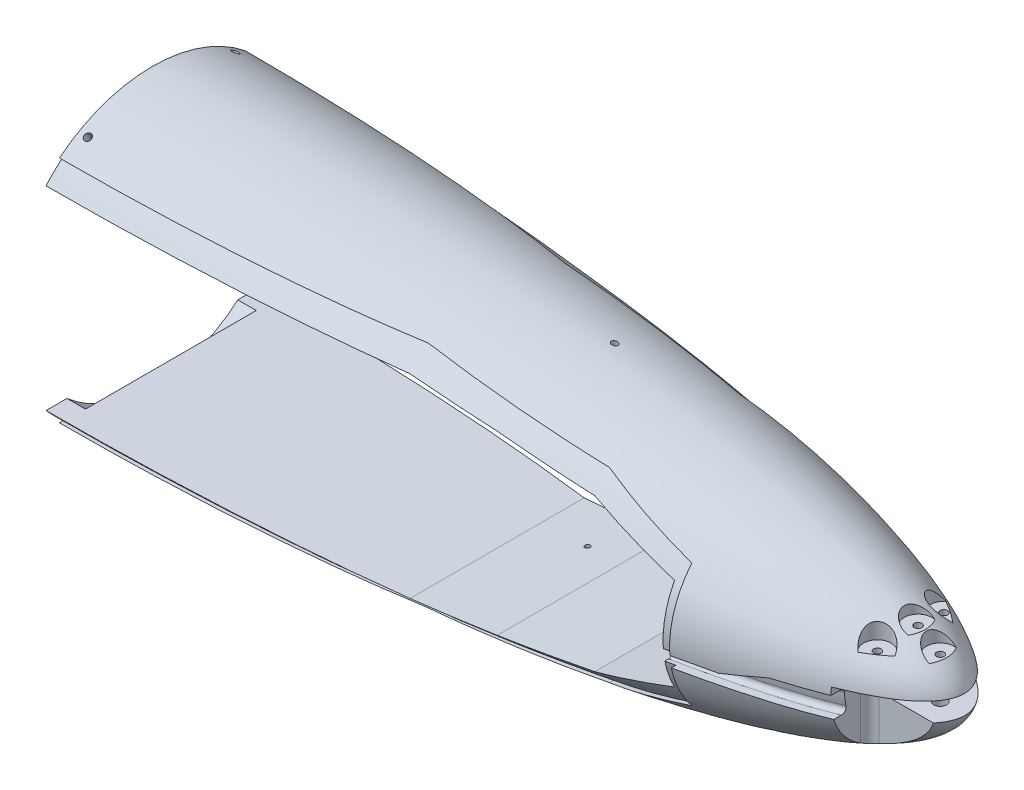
SolidWorks part; units mm, degrees
ref_plane "Plane1" through (0, 0, 0) normal (0, 0, 1) x (1, 0, 0)
ref_plane "Plane2" through (0, 0, 0) normal (0, 1, 0) x (1, 0, 0)
ref_plane "Plane3" through (0, 0, 0) normal (1, 0, 0) x (0, 0, -1)
sketch "Sketch1" plane through (0, 0, 0) normal (0, 0, 1) x (1, 0, 0)
  line L0 (0, 0) -> (558.8, 0) construction
  line L1 (558.8, 0) -> (0, 0)
  line L2 (0, 0) -> (0, 101.346)
  line L3 (0, 0) -> (558.8, 0) construction
  ellipse E0 centre (0, 0) end of major axis (558.8, 0) minor radius 101.346 (558.8, 0) -> (0, 101.346) ccw
  dimension "D1" = 558.8
  dimension "D2" = 101.346
revolve "Base-Revolve" add sketch "Sketch1" angle 180 about L0
sketch "Sketch2" plane through (0, 0, 0) normal (0, 0, 1) x (1, 0, 0)
  line L0 (415.29, 0) -> (0, 0) construction
  line L1 (0, 66.802) -> (236.728, 66.802)
  line L2 (236.728, 66.802) -> (294.64, 60.706)
  line L3 (294.64, 60.706) -> (358.14, 52.324)
  line L4 (358.14, 52.324) -> (415.29, 31.75)
  line L5 (415.29, 31.75) -> (415.29, -31.75)
  line L6 (0, -66.802) -> (0, 66.802)
  line L7 (358.14, -52.324) -> (415.29, -31.75)
  line L8 (294.64, -60.706) -> (358.14, -52.324)
  line L9 (236.728, -66.802) -> (294.64, -60.706)
  line L10 (0, -66.802) -> (236.728, -66.802)
  dimension "D1" = 236.728
  dimension "D2" = 57.912
  dimension "D3" = 63.5
  dimension "D4" = 57.15
  dimension "D5" = 66.802
  dimension "D6" = 60.706
  dimension "D7" = 52.324
  dimension "D8" = 31.75
  dimension "D9" = 415.29
extrude "Cut-Extrude2" cut sketch "Sketch2" against normal through all and the other way through all
sketch "Sketch3" plane through (0, 0, 0) normal (-1, 0, 0) x (0, 0, 1)
  line L0 (-101.346, 0) -> (-98.806, 0)
  arc A0 (76.2135, 66.802) -> (-76.2135, 66.802) centre (0, 0) ccw construction
  point P0 (0, 101.346)
  point P1 (101.346, 0)
  point P5 (-101.346, 0)
sketch "Sketch5" plane through (0, 0, 0) normal (-1, 0, 0) x (0, 0, 1)
  circle A0 centre (0, 0) radius 88.9
  dimension "D1" = 177.8
extrude "Cut-Extrude3" cut sketch "Sketch5" against normal blind 12.7
ref_plane "hole_off_plane" through (6.35, 0, 0) normal (-1, 0, 0) x (0, 0, 1)
ref_plane "perp_hole_plane" through (0, 0, 0) normal (0, 0.866, 0.5) x (-1, 0, 0)
sketch "Sketch9" plane through (0, 0, 0) normal (0, 0.866, 0.5) x (-1, 0, 0)
  line L0 (-6.35, -76.2135) -> (-6.35, 76.2135) construction
  circle A0 centre (-6.35, 0) radius 2.4257
  dimension "D1" = 4.8514
  dimension "D2" = 6.35
extrude "Cut-Extrude6" cut sketch "Sketch9" along normal through all
pattern_circular "CirPattern5" count 2 every 60 about axis through (0, 0, 0) along (1, 0, 0) of "Cut-Extrude6"
pattern_circular "CirPattern6" count 2 every 120 about axis through (0, 0, 0) along (1, 0, 0) of "Cut-Extrude6"
pattern_circular "CirPattern7" count 2 every 180 about axis through (6.35, 0, 0) along (0, -0.866, -0.5) of "Cut-Extrude6"
sketch "Sketch10" plane through (0, 0, 0) normal (0, 0, 1) x (1, 0, 0)
  line L0 (558.8, 7.0485) -> (558.8, 0)
  line L1 (558.8, 0) -> (558.8, -5.715)
  line L2 (558.8, -5.715) -> (508, -5.715)
  line L3 (508, -5.715) -> (508, 7.0485)
  line L5 (12.7, 0) -> (0, 0) construction
  line L6 (558.8, 7.0485) -> (508, 7.0485)
  line L8 (558.8, 0) -> (500.7158, 0) construction
  point P9 (508.0181, 0)
  dimension "D1" = 7.0485
  dimension "D2" = 50.8
  dimension "D3" = 5.715
extrude "tail_slot" cut sketch "Sketch10" against normal through all and the other way through all
sketch "Sketch11" plane through (0, 0, 0) normal (0, 1, 0) x (1, 0, 0)
  line L0 (558.8, -15.24) -> (514.35, -15.24)
  line L1 (508, -21.59) -> (508, -48.26)
  line L2 (508, -48.26) -> (558.8, -48.26)
  line L3 (558.8, -48.26) -> (558.8, -15.24)
  line L4 (0, 0) -> (558.8, 0) construction
  line L5 (12.7, 0) -> (0, 0) construction
  line L6 (0, 0) -> (558.8, 0) construction
  arc A0 (514.35, -15.24) -> (508, -21.59) centre (514.35, -21.59) ccw
  circle A1 centre (541.02, 0) radius 4.318
  circle A2 centre (525.7846, 0) radius 4.318
  circle A3 centre (520.7046, 22.86) radius 5.3581
  dimension "D4" = 6.35
  dimension "D5" = 8.636
  dimension "D6" = 17.78
  dimension "D7" = 15.2354
  dimension "D8" = 10.7163
  dimension "D9" = 5.08
  dimension "D10" = 22.86
  dimension "D1" = 50.8
  dimension "D2" = 33.02
  dimension "D3" = 15.24
extrude "tail pocket" cut sketch "Sketch11" against normal blind 76.2
sketch "Sketch24" plane through (0, 7.0485, 0) normal (0, -1, 0) x (1, 0, 0)
  line L0 (525.7846, 0) -> (541.02, 0) construction
  circle A0 centre (541.02, 0) radius 2.5797
  circle A1 centre (525.7846, 0) radius 2.5797
  circle A2 centre (520.7046, -22.86) radius 2.5797
  circle A3 centre (520.7046, 22.86) radius 2.5797
extrude "Tail Plate Mount HeliCoil Holes" cut sketch "Sketch24" against normal through all
ref_plane "Plane4" through (262.128, 0, 0) normal (-1, 0, 0) x (0, 0, 1)
sketch "Sketch12" plane through (262.128, 0, 0) normal (-1, 0, 0) x (0, 0, 1)
  circle A0 centre (0, 0) radius 89.5096
ref_plane "Tail Plate Mount Heli Coil Flats Plane" through (0, 44.45, 0) normal (0, 1, 0) x (-1, 0, 0)
sketch "Sketch25" plane through (0, 44.45, 0) normal (0, 1, 0) x (-1, 0, 0)
  circle A0 centre (-520.7046, -22.86) radius 9.525
  circle A1 centre (-520.7046, 22.86) radius 9.525
  dimension "D1" = 19.05
  dimension "D2" = 19.05
extrude "Outside HeliCoil Flats" cut sketch "Sketch25" against normal blind 19.05
sketch "Sketch26" plane through (0, 44.45, 0) normal (0, 1, 0) x (-1, 0, 0)
  circle A0 centre (-525.7846, 0) radius 9.525
extrude "Center FWD HeliCoil Flat" cut sketch "Sketch26" against normal blind 12.7
sketch "Sketch27" plane through (0, 44.45, 0) normal (0, 1, 0) x (-1, 0, 0)
  circle A0 centre (-541.02, 0) radius 9.525
  dimension "D1" = 19.05
extrude "Center AFT HeliCoil Flat" cut sketch "Sketch27" against normal blind 22.225
sketch "Sketch15" plane through (9.549, -90.7156, 0) normal (-0.1047, 0.9945, 0) x (-0.9945, -0.1047, 0)
  circle A0 centre (-262.128, -28.575) radius 1.7272
extrude "Cut-Extrude10" cut sketch "Sketch15" against normal through all
sketch "Sketch17" plane through (415.29, 0, 0) normal (-1, 0, 0) x (0, 0, 1)
  circle A1 centre (-13.208, 0) radius 2.413
  circle A2 centre (32.512, 0) radius 2.413
  dimension "D1" = 13.208
  dimension "D2" = 32.512
extrude "ADP Mount holes" cut sketch "Sketch17" against normal blind 19.05
ref_plane "Plane5" through (0, 0, 101.6) normal (0, 0, 1) x (1, 0, 0)
sketch "Sketch18" plane through (0, 0, 101.6) normal (0, 0, 1) x (1, 0, 0)
  line L1 (0, 0) -> (558.8, 0) construction
  line L2 (421.64, 42.418) -> (421.64, -42.418)
  line L3 (0, 66.802) -> (236.728, 66.802)
  line L4 (236.728, 66.802) -> (294.64, 60.706)
  line L5 (294.64, 60.706) -> (358.14, 52.324)
  line L6 (358.14, 52.324) -> (415.29, 31.75)
  line L7 (415.29, -31.75) -> (415.29, 31.75)
  line L8 (434.34, 0) -> (415.29, 0) construction
  line L9 (421.64, 42.418) -> (358.14, 64.008)
  line L10 (0, 66.802) -> (0, 78.74)
  line L11 (236.728, 78.74) -> (358.14, 64.008)
  line L12 (504.0721, 0) -> (0, 0) construction
  line L13 (0, -66.802) -> (0, -78.74)
  line L14 (236.728, -78.74) -> (0, -78.74)
  line L15 (236.728, -78.74) -> (358.14, -64.008)
  line L16 (421.64, -42.418) -> (358.14, -64.008)
  line L18 (236.728, 78.74) -> (0, 78.74)
  line L31 (358.14, -52.324) -> (415.29, -31.75)
  line L32 (294.64, -60.706) -> (358.14, -52.324)
  line L33 (236.728, -66.802) -> (294.64, -60.706)
  line L34 (0, -66.802) -> (236.728, -66.802)
  point P28 (421.64, 0)
  point P39 (415.29, 0)
  dimension "D4" = 121.412
  dimension "D2" = 64.008
  dimension "D3" = 236.728
  dimension "D5" = 63.5
  dimension "D6" = 421.64
  dimension "D7" = 42.418
  dimension "D10" = 78.74
extrude "cowling mill TOP" cut sketch "Sketch18" against normal offset from surface (28.5615 mm away) 3.175
mirror "Mirror cowling mill bottom" about plane through (0, 0, 0) normal (0, 0, 1) of "cowling mill TOP"
sketch "Sketch19" plane through (0, 0, 0) normal (0, 1, 0) x (1, 0, 0)
  line L0 (0, 0) -> (558.8, 0) construction
  line L1 (415.29, 64.6345) -> (415.29, 56.7422) construction
  circle A0 centre (306.07, 11.43) radius 2.159
  dimension "D1" = 4.318
  dimension "D2" = 11.43
  dimension "D3" = 109.22
extrude "alt_mount_hole" cut sketch "Sketch19" along normal through all
sketch "Sketch20" plane through (415.29, 0, 0) normal (-1, 0, 0) x (0, 0, 1)
  line L0 (-57.901, 60.706) -> (57.901, 60.706) construction
  circle A0 centre (-34.29, 9.906) radius 25.4
  dimension "D1" = 50.8
  dimension "D2" = 34.29
  dimension "D3" = 50.8
extrude "alt_pocket" cut sketch "Sketch20" against normal blind 8.89 and the other way through all
sketch "Sketch21" plane through (0, 0, 0) normal (0, 1, 0) x (1, 0, 0)
  line L0 (306.07, 11.43) -> (306.07, 0) construction
  line L3 (0, 0) -> (558.8, 0) construction
  line L5 (306.07, 11.43) -> (306.07, 34.29) construction
  line L6 (306.07, 34.29) -> (415.29, 34.29) construction
  line L8 (415.29, 34.29) -> (415.29, 0) construction
  line L10 (415.29, 59.69) -> (415.29, 11.8506) construction
  line L11 (415.29, 21.3285) -> (415.29, -56.7422) construction
  line L12 (306.07, 11.43) -> (415.29, 34.29) construction
  dimension "D1" = 11.821
ref_plane "antenna cable pocket plane" through (0, 0, 101.346) normal (0, 0, 1) x (1, 0, 0)
sketch "Sketch23" plane through (0, 0, 101.346) normal (0, 0, 1) x (1, 0, 0)
  line L0 (508, 2.286) -> (476.25, 2.286)
  line L1 (0, 0) -> (558.8, 0) construction
  line L5 (508, 2.286) -> (508, -12.954)
  line L7 (508, -12.954) -> (415.29, -12.954)
  line L8 (415.29, 31.75) -> (415.29, -31.75) construction
  line L9 (415.29, -12.954) -> (415.29, -5.0165)
  line L10 (415.29, -5.0165) -> (448.9967, -5.0165)
  line L11 (476.25, 2.286) -> (448.9967, -5.0165)
  dimension "D1" = 15
  dimension "D2" = 7.9375
  dimension "D3" = 15.24
  dimension "D4" = 31.75
  dimension "D5" = 2.286
extrude "antenna cable pocket" cut sketch "Sketch23" against normal offset from surface (68.7124 mm away) 9.525
fillet "Fillet1" radius 3.175 1 edges at (476.25, 2.286, 48.202)
fillet "Fillet2" radius 3.175 5 edges
ref_plane "Bottom groove plane" through (0, 0, -101.346) normal (0, 0, 1) x (1, 0, 0)
sketch "Sketch28" plane through (0, 0, -101.346) normal (0, 0, 1) x (1, 0, 0)
  line L0 (558.3008, 0) -> (558.3008, 7.0485)
  line L2 (0, 0) -> (558.8, 0) construction
  line L3 (558.3008, 7.0485) -> (415.29, 7.0485)
  line L4 (415.29, 31.75) -> (415.29, -31.75) construction
  line L5 (415.29, 7.0485) -> (415.29, 0)
  line L6 (415.29, 0) -> (558.3008, 0)
extrude "Bottom groove" cut sketch "Sketch28" along normal offset from surface (209.043 mm away) 3.175
sketch "Sketch29" plane through (0, 0, -101.346) normal (0, 0, 1) x (1, 0, 0)
  line L0 (425.45, 7.0485) -> (425.45, 0.6985)
  line L1 (421.64, 7.0485) -> (508, 7.0485) construction
  line L2 (425.45, 0.6985) -> (447.675, 0.6985)
  line L3 (447.675, 0.6985) -> (447.675, 7.0485)
  line L4 (447.675, 7.0485) -> (425.45, 7.0485)
  line L5 (508, 0) -> (508, 7.0485) construction
  dimension "D1" = 60.325
  dimension "D2" = 22.225
  dimension "D3" = 6.35
extrude "Bottom groove pocket" cut sketch "Sketch29" along normal blind 47.625
fillet "Bottom groove pocket fillets" radius 1.5875 4 edges at (447.675, 7.0485, -55.3944) (447.675, 0.6985, -55.5979) (425.45, 0.6985, -58.1237) (425.45, 7.0485, -57.936)
